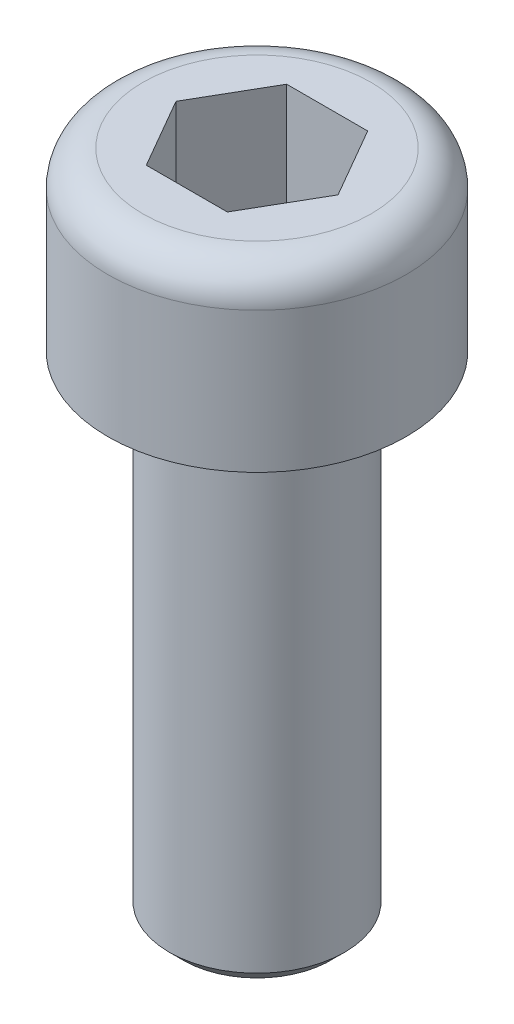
SolidWorks part; units mm, degrees
ref_plane "Plan1" through (0, 0, 0) normal (0, 0, 1) x (1, 0, 0)
ref_plane "Plan2" through (0, 0, 0) normal (0, 1, 0) x (1, 0, 0)
ref_plane "Plan3" through (0, 0, 0) normal (1, 0, 0) x (0, 0, -1)
sketch "Esquisse1" plane through (0, 0, 0) normal (0, 0, 1) x (1, 0, 0)
  line L0 (0, 5) -> (0, -14) construction
  line L1 (0, 5) -> (3.25, 5)
  line L2 (4.25, 4) -> (4.25, 0)
  line L3 (4.25, 0) -> (2.75, 0)
  line L4 (2.5, -0.25) -> (2.5, -13.6)
  line L5 (2.1, -14) -> (0, -14)
  line L6 (2.5, -13.6) -> (2.1, -14)
  line L7 (0, -14) -> (0, 5)
  arc A0 (3.25, 5) -> (4.25, 4) centre (3.25, 4) cw
  arc A1 (2.75, 0) -> (2.5, -0.25) centre (2.75, -0.25) ccw
  point P12 (2.5, -14)
  dimension "C2" = 0.25
  dimension "C1" = 1
  dimension "D1" = 8.5
  dimension "R" = 0.4
  dimension "D2" = 45
  dimension "L1" = 14
  dimension "H" = 5
  dimension "D" = 5
revolve "Révolution1" add sketch "Esquisse1" angle 360 about L0
sketch "Esquisse2" plane through (0, 5, 0) normal (0, 1, 0) x (1, 0, 0)
  line L1 (2.3094, 0) -> (1.1547, 2)
  line L2 (1.1547, 2) -> (-1.1547, 2)
  line L3 (-1.1547, 2) -> (-2.3094, 0)
  line L4 (-2.3094, 0) -> (-1.1547, -2)
  line L5 (-1.1547, -2) -> (1.1547, -2)
  line L6 (1.1547, -2) -> (2.3094, 0)
  circle A0 centre (0, 0) radius 2 construction
  dimension "S" = 4
extrude "Enlèv. mat.-Extru.1" cut sketch "Esquisse2" against normal blind 3.125
equation "\"C1@Esquisse1\" = \"D@Esquisse1\"/5"
equation "\"Prof@Enlèv. mat.-Extru.1\" = \"D@Esquisse1\"*0.625"
equation "\"H@Esquisse1\" = \"D@Esquisse1\""
equation "\"C2@Esquisse1\"=\"D@Esquisse1\"/20"
equation "\"R@Esquisse1\"=(\"D@Esquisse1\"-\"D2@Représentation de filetage1\")/2"
